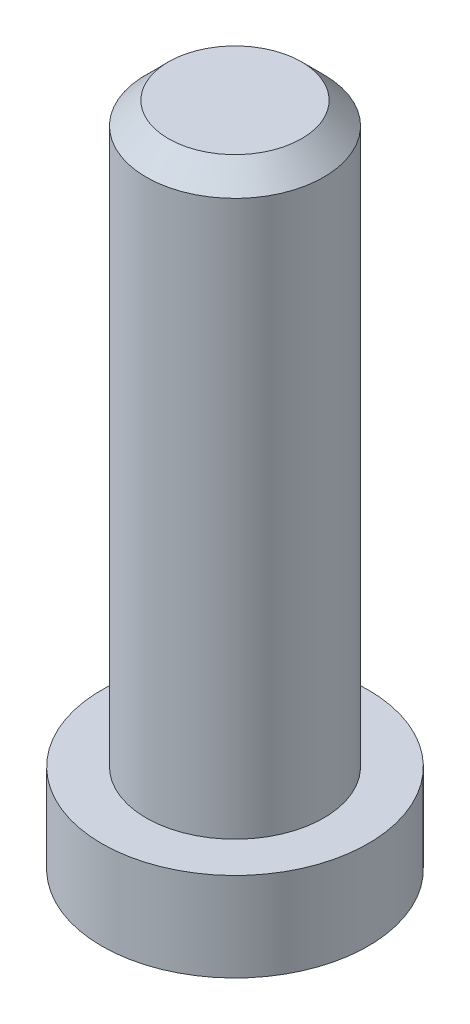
SolidWorks part; units mm, degrees
ref_plane "Alzado" through (0, 0, 0) normal (0, 0, 1) x (1, 0, 0)
ref_plane "Planta" through (0, 0, 0) normal (0, 1, 0) x (1, 0, 0)
ref_plane "Vista lateral" through (0, 0, 0) normal (1, 0, 0) x (0, 0, -1)
sketch "Croquis1" plane through (0, 0, 0) normal (0, 1, 0) x (1, 0, 0)
  circle A0 centre (0, 0) radius 3
  dimension "D1" = 6
extrude "Saliente-Extruir1" add sketch "Croquis1" along normal blind 2
sketch "Croquis2" plane through (0, 2, 0) normal (0, 1, 0) x (1, 0, 0)
  circle A0 centre (0, 0) radius 2
  dimension "D1" = 4
extrude "Saliente-Extruir2" add sketch "Croquis2" along normal blind 13
chamfer "Chaflán1" distance 0.5 angle 45 1 edges at (0, 15, 2)
